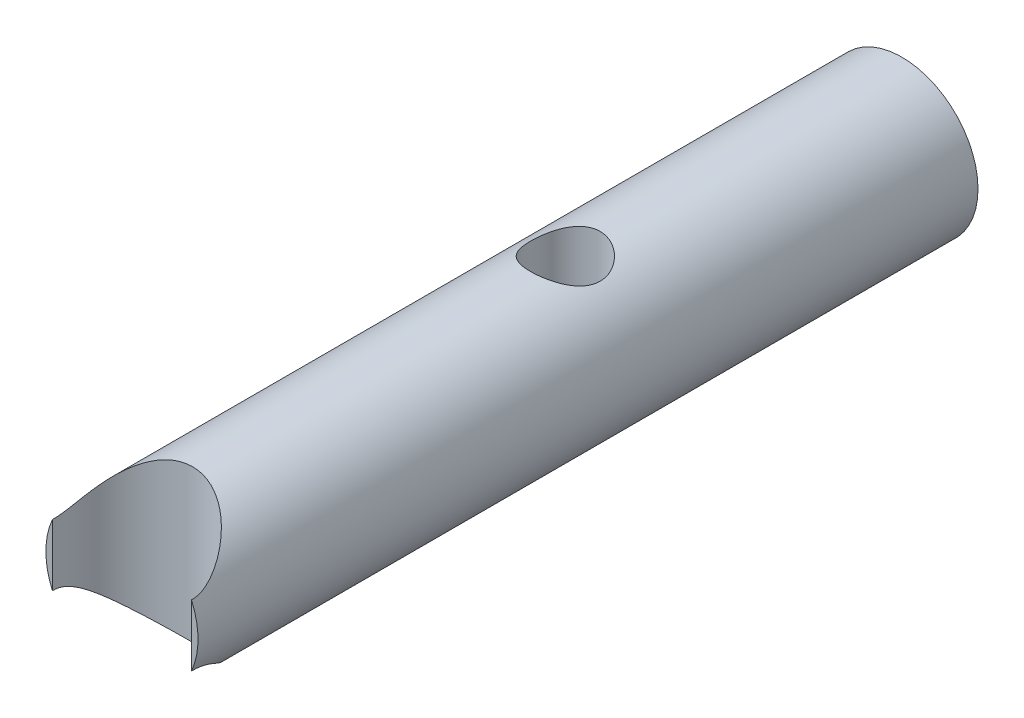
SolidWorks part; units mm, degrees
ref_plane "Face" through (0, 0, 0) normal (0, 0, 1) x (1, 0, 0)
ref_plane "Dessus" through (0, 0, 0) normal (0, 1, 0) x (1, 0, 0)
ref_plane "Droite" through (0, 0, 0) normal (1, 0, 0) x (0, 0, -1)
sketch "Esquisse1" plane through (0, 0, 0) normal (0, 0, 1) x (1, 0, 0)
  circle A0 centre (0, 0) radius 2.735
  dimension "D1" = 5.47
extrude "Base-Extrusion" add sketch "Esquisse1" along normal blind 28.04
sketch "Esquisse2" plane through (0, 0, 0) normal (0, 1, 0) x (1, 0, 0)
  line L0 (0, -28.04) -> (0, 0) construction
  circle A0 centre (0, -28) radius 2.5
  dimension "D1" = 5
extrude "Enlèv. mat.-Extru.1" cut sketch "Esquisse2" against normal through all and the other way through all
sketch "Esquisse3" plane through (0, 0, 0) normal (0, 1, 0) x (1, 0, 0)
  line L0 (0, -28.04) -> (0, 0) construction
  line L1 (2.735, 0) -> (-2.735, 0) construction
  circle A0 centre (0, -12.1) radius 1.25
  dimension "D1" = 2.5
  dimension "D2" = 12.1
extrude "Enlèv. mat.-Extru.2" cut sketch "Esquisse3" against normal through all and the other way through all
